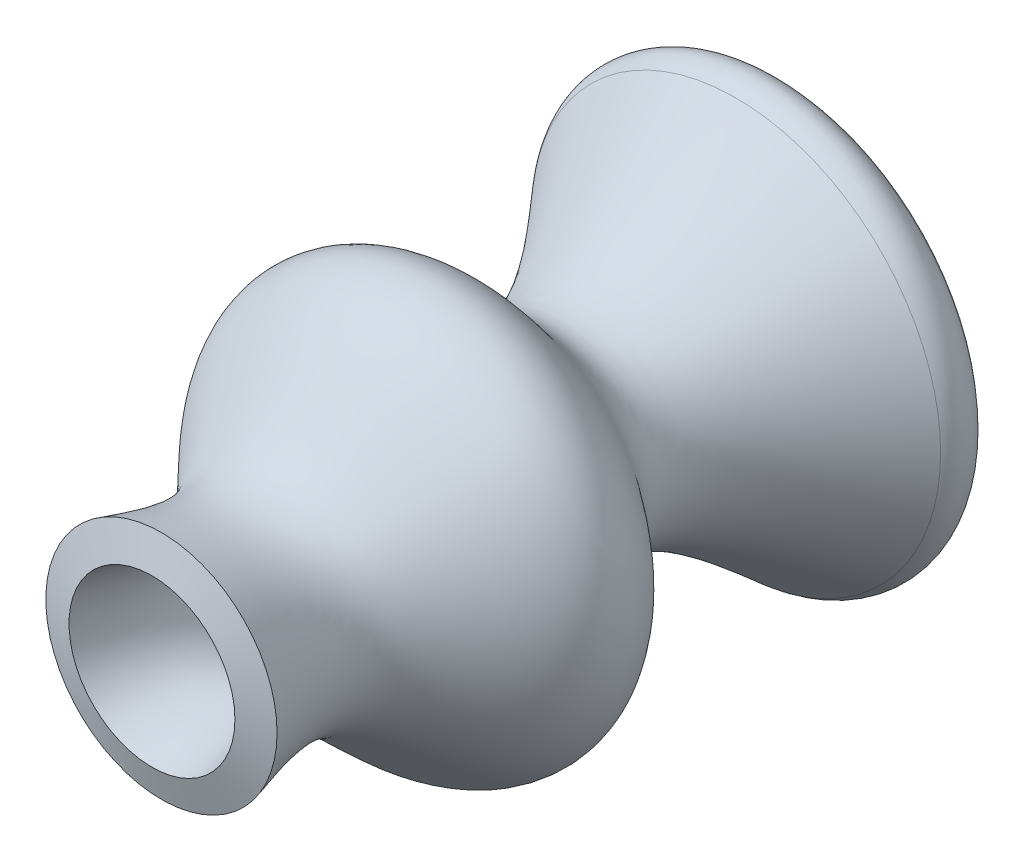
SolidWorks part; units mm, degrees
ref_plane "Ebene vorne" through (0, 0, 0) normal (0, 0, 1) x (1, 0, 0)
ref_plane "Ebene oben" through (0, 0, 0) normal (0, 1, 0) x (1, 0, 0)
ref_plane "Ebene rechts" through (0, 0, 0) normal (1, 0, 0) x (0, 0, -1)
sketch "Skizze1" plane through (0, 0, 0) normal (1, 0, 0) x (0, 0, -1)
  line L0 (0, 0) -> (207.4317, 0) construction
  spline S0 degree 3 poles (0, 29.2554) (17.0271, 24.3169) (53.9121, 13.619) (94.4499, 82.4426) (137.3576, -4.1978) (186.2262, 38.8549) (221.3474, 69.7962) knots 0 0 0 0 0.197162 0.427103 0.588267 1 1 1 1
revolve "Rotation-Dünn1" add sketch "Skizze1" angle 360 about L0
fillet "Verrundung1" radius 10 1 edges at (78.8003, 0, -213.4149)
